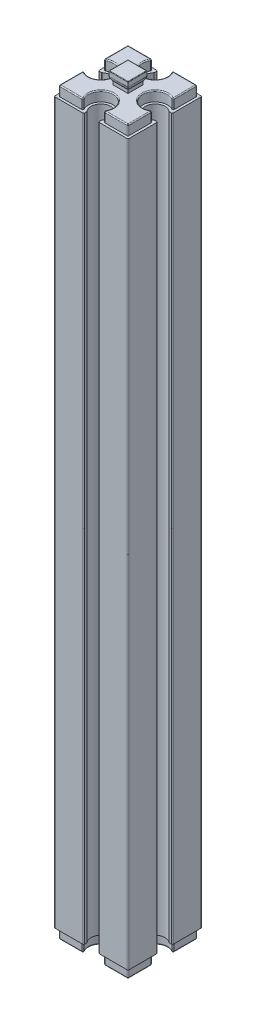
SolidWorks part; units mm, degrees
ref_plane "前视基准面" through (0, 0, 0) normal (0, 0, 1) x (1, 0, 0)
ref_plane "上视基准面" through (0, 0, 0) normal (0, 1, 0) x (1, 0, 0)
ref_plane "右视基准面" through (0, 0, 0) normal (1, 0, 0) x (0, 0, -1)
sketch "草图1" plane through (0, 0, 0) normal (0, 1, 0) x (1, 0, 0)
  line L0 (0, 0) -> (0, 7.5) construction
  line L1 (0, 0) -> (7.5, 0) construction
  line L2 (-7.5, 7.5) -> (-1.5, 7.5)
  line L3 (7.5, 7.5) -> (7.5, 1.5)
  line L4 (6.8229, 1.5) -> (7.5, 1.5)
  line L5 (6.8229, -1.5) -> (7.5, -1.5)
  line L6 (0, 7.5) -> (0, 5.5) construction
  line L7 (-1.5, 6.8229) -> (-1.5, 7.5)
  line L8 (1.5, 6.8229) -> (1.5, 7.5)
  line L9 (1.5, 7.5) -> (7.5, 7.5)
  line L10 (7.5, -1.5) -> (7.5, -7.5)
  line L11 (7.5, -7.5) -> (1.5, -7.5)
  line L12 (1.5, -6.8229) -> (1.5, -7.5)
  line L13 (-1.5, -6.8229) -> (-1.5, -7.5)
  line L14 (-1.5, -7.5) -> (-7.5, -7.5)
  line L15 (-7.5, -7.5) -> (-7.5, -1.5)
  line L16 (-6.8229, -1.5) -> (-7.5, -1.5)
  line L17 (-6.8229, 1.5) -> (-7.5, 1.5)
  line L18 (-7.5, 1.5) -> (-7.5, 7.5)
  arc A0 (-1.5, 6.8229) -> (1.5, 6.8229) centre (0, 5.5) ccw
  arc A1 (6.8229, 1.5) -> (6.8229, -1.5) centre (5.5, 0) ccw
  arc A2 (1.5, -6.8229) -> (-1.5, -6.8229) centre (0, -5.5) ccw
  arc A3 (-6.8229, -1.5) -> (-6.8229, 1.5) centre (-5.5, 0) ccw
  point P36 (0, 0)
  dimension "D6" = 4
  dimension "D7" = 2
  dimension "D1" = 7.5
  dimension "D2" = 7.5
  dimension "D3" = 2
  dimension "D4" = 7.5
  dimension "D5" = 1.5
extrude "凸台-拉伸1" add sketch "草图1" along normal blind 73
sketch "草图2" plane through (0, 73, 0) normal (0, 1, 0) x (1, 0, 0)
  line L0 (-7, 7) -> (-7, 2)
  line L1 (-7, 2) -> (-7, 2)
  line L2 (-7, -2) -> (-7, -2)
  line L3 (-7, -2) -> (-7, -7)
  line L4 (-7, -7) -> (-2, -7)
  line L5 (-2, -7) -> (-2, -7)
  line L6 (2, -7) -> (2, -7)
  line L7 (2, -7) -> (7, -7)
  line L8 (7, -7) -> (7, -2)
  line L9 (7, -2) -> (7, -2)
  line L10 (7, 2) -> (7, 2)
  line L11 (7, 2) -> (7, 7)
  line L12 (7, 7) -> (2, 7)
  line L13 (2, 7) -> (2, 7)
  line L14 (-2, 7) -> (-2, 7)
  line L15 (-2, 7) -> (-7, 7)
  line L16 (-7.5, 7.5) -> (-7.5, 1.5)
  line L17 (-7.5, 1.5) -> (-6.8229, 1.5)
  line L18 (-6.8229, -1.5) -> (-7.5, -1.5)
  line L19 (-7.5, -1.5) -> (-7.5, -7.5)
  line L20 (-7.5, -7.5) -> (-1.5, -7.5)
  line L21 (-1.5, -7.5) -> (-1.5, -6.8229)
  line L22 (1.5, -6.8229) -> (1.5, -7.5)
  line L23 (1.5, -7.5) -> (7.5, -7.5)
  line L24 (7.5, -7.5) -> (7.5, -1.5)
  line L25 (7.5, -1.5) -> (6.8229, -1.5)
  line L26 (6.8229, 1.5) -> (7.5, 1.5)
  line L27 (7.5, 1.5) -> (7.5, 7.5)
  line L28 (7.5, 7.5) -> (1.5, 7.5)
  line L29 (1.5, 7.5) -> (1.5, 6.8229)
  line L30 (-1.5, 6.8229) -> (-1.5, 7.5)
  line L31 (-1.5, 7.5) -> (-7.5, 7.5)
  line L32 (-7.5, 7.5) -> (-7.5, 1.5) construction
  line L33 (-7.5, 1.5) -> (-6.8229, 1.5) construction
  line L34 (-6.8229, -1.5) -> (-7.5, -1.5) construction
  line L35 (-7.5, -1.5) -> (-7.5, -7.5) construction
  line L36 (-7.5, -7.5) -> (-1.5, -7.5) construction
  line L37 (-1.5, -7.5) -> (-1.5, -6.8229) construction
  line L38 (1.5, -6.8229) -> (1.5, -7.5) construction
  line L39 (1.5, -7.5) -> (7.5, -7.5) construction
  line L40 (7.5, -7.5) -> (7.5, -1.5) construction
  line L41 (7.5, -1.5) -> (6.8229, -1.5) construction
  line L42 (6.8229, 1.5) -> (7.5, 1.5) construction
  line L43 (7.5, 1.5) -> (7.5, 7.5) construction
  line L44 (7.5, 7.5) -> (1.5, 7.5) construction
  line L45 (1.5, 7.5) -> (1.5, 6.8229) construction
  line L46 (-1.5, 6.8229) -> (-1.5, 7.5) construction
  line L47 (-1.5, 7.5) -> (-7.5, 7.5) construction
  arc A0 (-7, -2) -> (-7, 2) centre (-5.5, 0) ccw
  arc A1 (2, -7) -> (-2, -7) centre (0, -5.5) ccw
  arc A2 (7, 2) -> (7, -2) centre (5.5, 0) ccw
  arc A3 (-2, 7) -> (2, 7) centre (0, 5.5) ccw
  arc A4 (-6.8229, -1.5) -> (-6.8229, 1.5) centre (-5.5, 0) ccw
  arc A5 (1.5, -6.8229) -> (-1.5, -6.8229) centre (0, -5.5) ccw
  arc A6 (6.8229, 1.5) -> (6.8229, -1.5) centre (5.5, 0) ccw
  arc A7 (-1.5, 6.8229) -> (1.5, 6.8229) centre (0, 5.5) ccw
  arc A8 (-6.8229, -1.5) -> (-6.8229, 1.5) centre (-5.5, 0) ccw construction
  arc A9 (1.5, -6.8229) -> (-1.5, -6.8229) centre (0, -5.5) ccw construction
  arc A10 (6.8229, 1.5) -> (6.8229, -1.5) centre (5.5, 0) ccw construction
  arc A11 (-1.5, 6.8229) -> (1.5, 6.8229) centre (0, 5.5) ccw construction
  dimension "D1" = 0
  dimension "D2" = 0.5
extrude "凸台-拉伸2" add sketch "草图2" along normal blind 2
sketch "草图3" plane through (0, 0, 0) normal (1, 0, 0) x (0, 0, -1)
  line L0 (0, 75) -> (0, 77) construction
  line L1 (2.5, 75) -> (-2.5, 75) construction
  line L2 (0, 77) -> (0, 77.5) construction
  line L3 (-1.5, 75) -> (1.5, 75)
  line L4 (1.5, 75) -> (1.5, 75.6771)
  line L5 (-1.95, 77.5) -> (1.95, 77.5)
  line L6 (1.95, 77.5) -> (1.95, 76.5556)
  line L7 (-1.5, 75) -> (-1.5, 75.6771)
  line L8 (-1.95, 77.5) -> (-1.95, 76.5556)
  arc A0 (-1.5, 75.6771) -> (-1.95, 76.5556) centre (0, 77) cw
  arc A1 (1.5, 75.6771) -> (1.95, 76.5556) centre (0, 77) ccw
  dimension "D5" = 2
  dimension "D1" = 2
  dimension "D2" = 0.5
  dimension "D3" = 1.5
  dimension "D4" = 1.95
extrude "凸台-拉伸3" add sketch "草图3" along normal blind 2 and the other way blind 2
sketch "草图4" plane through (0, 0, 0) normal (0, 0, 1) x (1, 0, 0)
  line L0 (0, 75) -> (0, 77) construction
  line L2 (-2, 75) -> (2, 75) construction
  line L3 (0, 77) -> (0, 77.5) construction
  line L4 (-2, 77.5) -> (2, 77.5) construction
  line L5 (1.95, 77.5) -> (2, 77.5)
  line L6 (-1.95, 77.5) -> (-1.95, 76.5556)
  line L9 (-1.5, 75) -> (-1.5, 75.6771)
  line L10 (1.5, 75) -> (1.5, 75.6771)
  line L11 (1.95, 77.5) -> (1.95, 76.5556)
  line L12 (1.5, 75) -> (2, 75)
  line L13 (-2, 77.5) -> (-1.95, 77.5)
  line L14 (-2, 77.5) -> (-2, 75)
  line L15 (-2, 75) -> (-1.5, 75)
  line L16 (2, 77.5) -> (2, 75)
  arc A0 (-1.95, 76.5556) -> (-1.5, 75.6771) centre (0, 77) ccw
  arc A1 (1.95, 76.5556) -> (1.5, 75.6771) centre (0, 77) cw
  dimension "D1" = 2
  dimension "D2" = 1.5
  dimension "D3" = 1.95
fillet "圆角3" radius 0.2 13 edges at (-1.5, 36.5, -7.5) (1.5, 36.5, -7.5) (7.5, 36.5, -7.5) (7.5, 36.5, -1.5) (7.5, 36.5, 1.5) (7.5, 36.5, 7.5) (-1.5, 36.5, 7.5) (1.5, 36.5, 7.5) (-6.8229, 36.5, -1.5) (-7.5, 36.5, 7.5) (-7.5, 36.5, 1.5) (-7.5, 36.5, -1.5) (-7.5, 36.5, -7.5)
extrude "切除-拉伸1" cut sketch "草图4" against normal blind 3 and the other way blind 3
fillet "圆角4" radius 0.2 24 edges at (0, 75, 3) (-3, 75, 0) (0, 75, -3) (3, 75, 0) (7, 74, 2) (7, 74, -2) (2, 74, -7) (-2, 74, -7) (-7, 74, 2) (-7, 74, -2) (2, 74, 7) (-2, 74, 7) (7, 74, 7) (4.5, 75, 7) (7, 75, 4.5) (7, 75, -4.5) (7, 74, -7) (4.5, 75, -7) (-4.5, 75, -7) (-7, 74, -7) (-7, 75, -4.5) (-4.5, 75, 7) (-7, 75, 4.5) (-7, 74, 7)
fillet "圆角5" radius 0.1 4 edges at (0, 77.5, -1.95) (1.95, 77.5, 0) (0, 77.5, 1.95) (-1.95, 77.5, 0)
mirror "镜向1" of "圆角5", "圆角4", "切除-拉伸1", "圆角3", "凸台-拉伸3", "凸台-拉伸2", "凸台-拉伸1"
